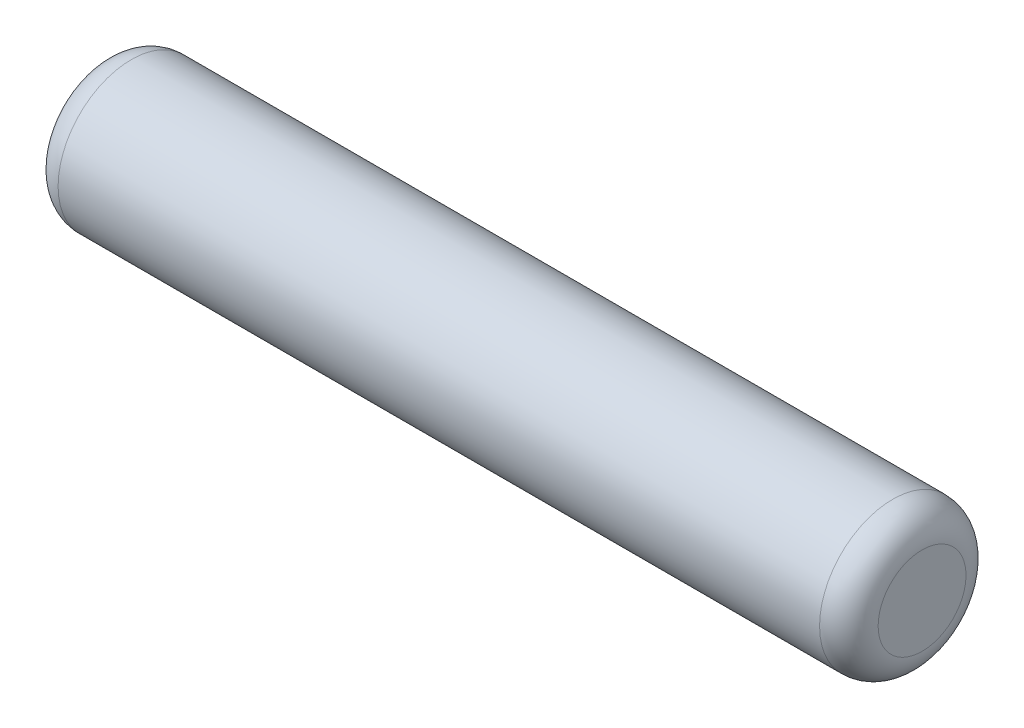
SolidWorks part; units mm, degrees
ref_plane "Front" through (0, 0, 0) normal (0, 0, 1) x (1, 0, 0)
ref_plane "Top" through (0, 0, 0) normal (0, 1, 0) x (1, 0, 0)
ref_plane "Right" through (0, 0, 0) normal (1, 0, 0) x (0, 0, -1)
sketch "Sketch1" plane through (0, 0, 0) normal (0, 0, 1) x (1, 0, 0)
  line L0 (-14, 0) -> (14, 0)
  line L1 (-16.3298, 0) -> (15.747, 0) construction
  line L2 (0, 0) -> (0, 7.8871) construction
  line L3 (-14, 0) -> (-14, 1.5)
  line L4 (-13, 2.5) -> (13, 2.5)
  line L5 (14, 1.5) -> (14, 0)
  arc A0 (13, 2.5) -> (14, 1.5) centre (13, 1.5) cw
  arc A1 (-14, 1.5) -> (-13, 2.5) centre (-13, 1.5) cw
  point P11 (14, 2.5)
  dimension "D1" = 5
  dimension "D3" = 1
  dimension "D2" = 28
revolve "Revolve1" add sketch "Sketch1" angle 360 about L1
